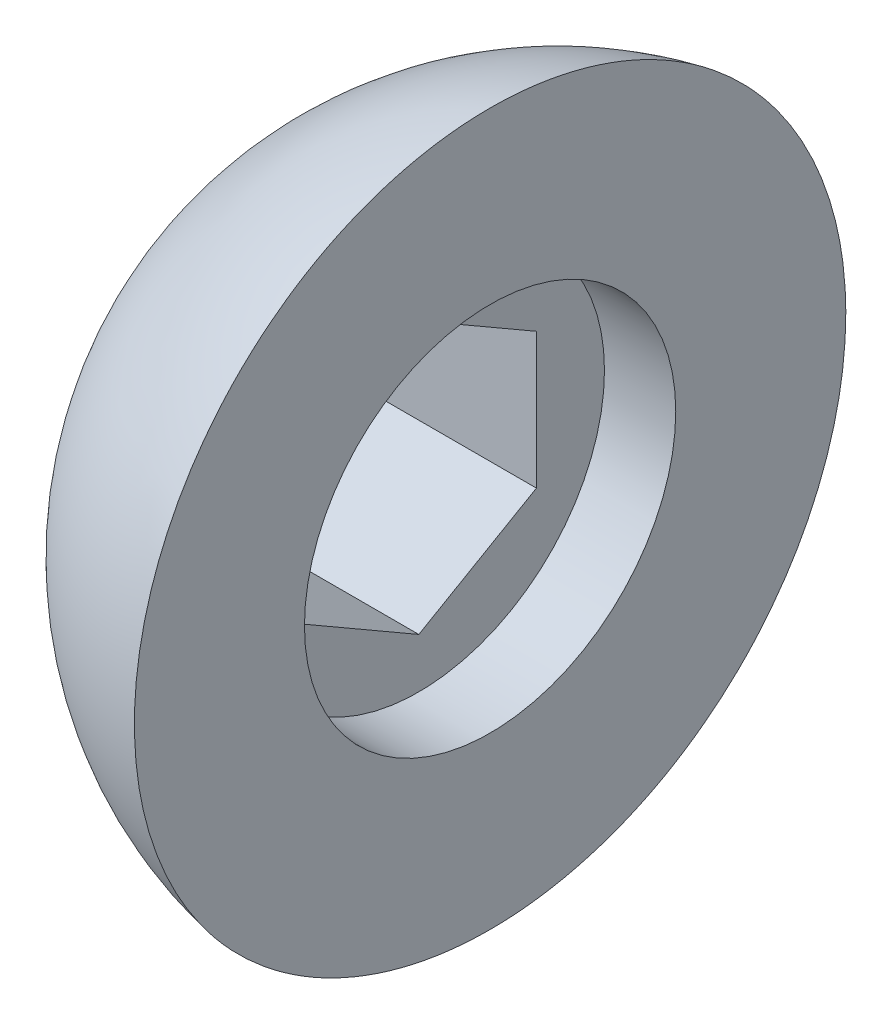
SolidWorks part; units mm, degrees
ref_plane "Front" through (0, 0, 0) normal (0, 0, 1) x (1, 0, 0)
ref_plane "Top" through (0, 0, 0) normal (0, 1, 0) x (1, 0, 0)
ref_plane "Right" through (0, 0, 0) normal (1, 0, 0) x (0, 0, -1)
imported_body "Imported1"
sketch "Sketch1" plane through (1.9261, 0, 0) normal (1, 0, 0) x (0, 0, -1)
  circle A0 centre (0, 0) radius 2.6043
extrude "Cut-Extrude1" cut sketch "Sketch1" against normal blind 1
